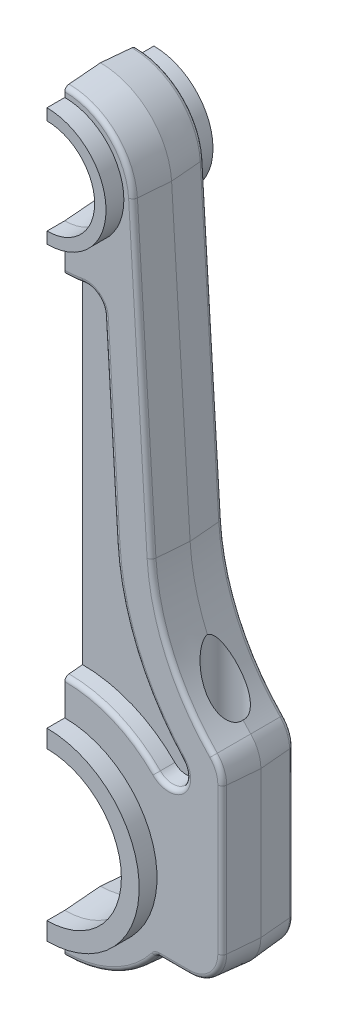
SolidWorks part; units mm, degrees
ref_plane "Front Plane" through (0, 0, 0) normal (0, 0, 1) x (1, 0, 0)
ref_plane "Top Plane" through (0, 0, 0) normal (0, 1, 0) x (1, 0, 0)
ref_plane "Right Plane" through (0, 0, 0) normal (1, 0, 0) x (0, 0, -1)
imported_body "Imported1"
scale "Scale1" scale about centroid uniform scaling yes scale factor 2
sketch "Sketch1" plane through (0, 0, 0) normal (0, 0, 1) x (1, 0, 0)
  line L0 (0, 199.2894) -> (0, -105.7236)
sketch "Sketch2" plane through (0, 0, 0) normal (0, 0, 1) x (1, 0, 0)
  line L0 (0, 209.3025) -> (0, -98.0212)
extrude "Cut-Extrude1" cut sketch "Sketch2" against normal through all and the other way through all flip side to cut
